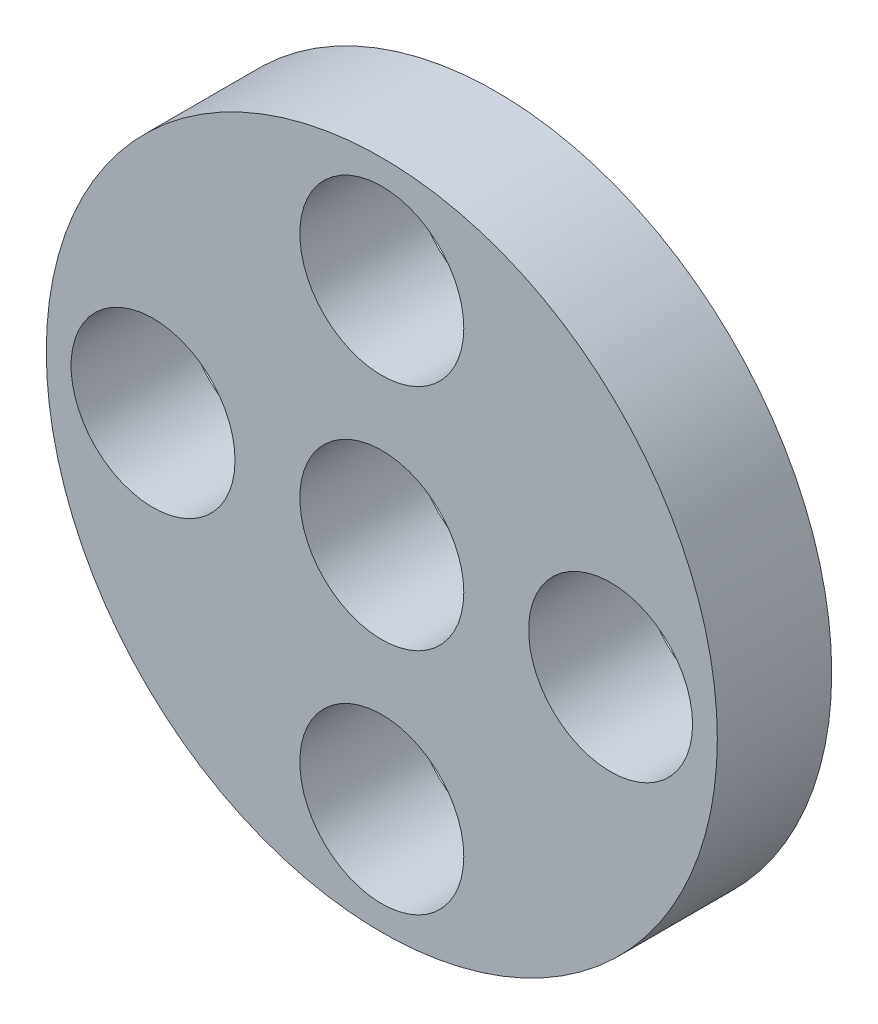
SolidWorks part; units mm, degrees
ref_plane "Front Plane" through (0, 0, 0) normal (0, 0, 1) x (1, 0, 0)
ref_plane "Top Plane" through (0, 0, 0) normal (0, 1, 0) x (1, 0, 0)
ref_plane "Right Plane" through (0, 0, 0) normal (1, 0, 0) x (0, 0, -1)
sketch "Sketch1" plane through (0, 0, 0) normal (0, 0, 1) x (1, 0, 0)
  circle A0 centre (0, 0) radius 8.8
  circle A1 centre (0, 0) radius 6 construction
  circle A2 centre (0, 6) radius 2.15
  circle A3 centre (6, 0) radius 2.15
  circle A4 centre (0, -6) radius 2.15
  circle A5 centre (-6, 0) radius 2.15
  circle A6 centre (0, 0) radius 2.15
  dimension "D1" = 17.6
  dimension "D2" = 12
  dimension "D3" = 4.3
extrude "Boss-Extrude1" add sketch "Sketch1" along normal blind 3
sketch "Sketch2" plane through (0, 0, 0) normal (0, 0, -1) x (-1, 0, 0)
  line L0 (0, 6) -> (0, -6) construction
